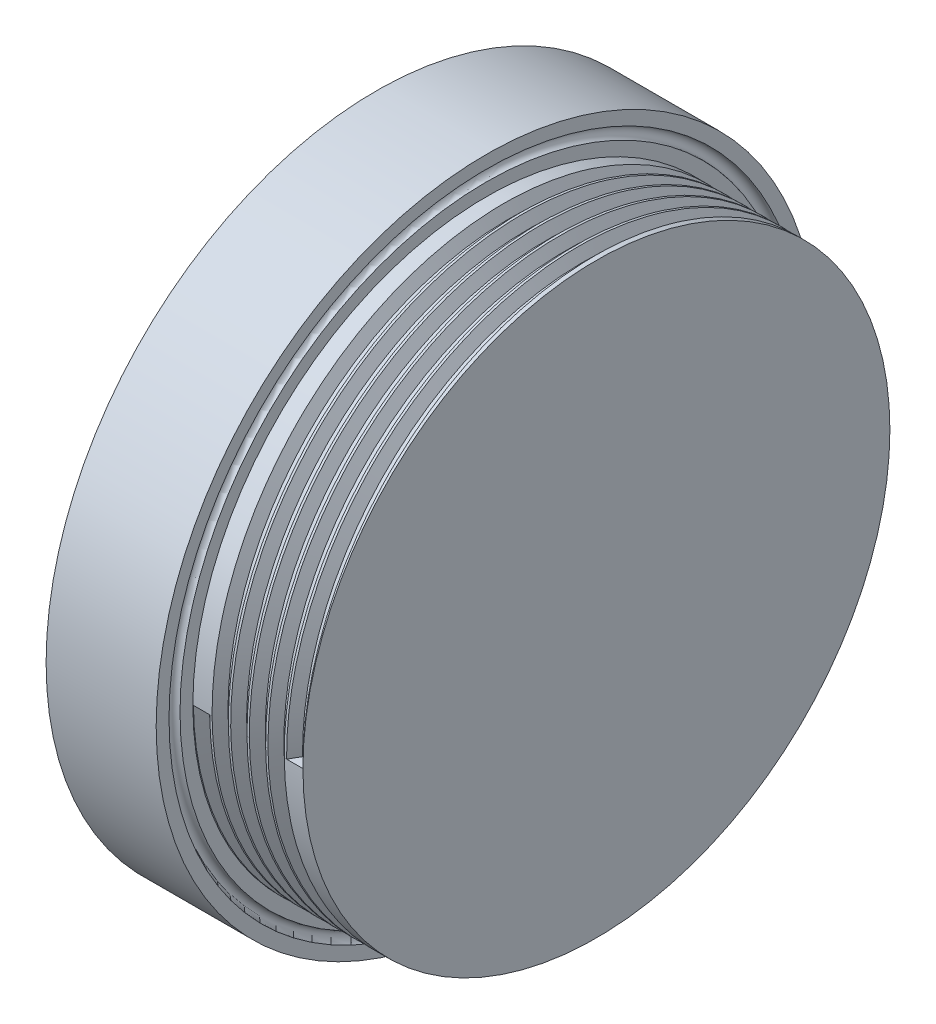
SolidWorks part; units mm, degrees
ref_plane "Front Plane" through (0, 0, 0) normal (0, 0, 1) x (1, 0, 0)
ref_plane "Top Plane" through (0, 0, 0) normal (0, 1, 0) x (1, 0, 0)
ref_plane "Right Plane" through (0, 0, 0) normal (1, 0, 0) x (0, 0, -1)
sketch "Sketch1" plane through (0, 0, 0) normal (0, 0, 1) x (1, 0, 0)
  line L0 (0, 0) -> (60, 0)
  line L1 (60, 0) -> (60, 80)
  line L2 (60, 80) -> (30, 80)
  line L4 (30, 90) -> (0, 90)
  line L5 (0, 90) -> (0, 0)
  line L6 (30, 90) -> (30, 86.5)
  line L7 (30, 80) -> (30, 83.5)
  arc A0 (30, 86.5) -> (30, 83.5) centre (30, 85) ccw
  dimension "D4" = 1.5
  dimension "D1" = 90
  dimension "D2" = 30
  dimension "D3" = 10
revolve "Body" add sketch "Sketch1" angle 360 about L0
thread "Thread" pitch 5.08 start angle 0, offset 0, length 0, pitch 5.08, diameter 160
ref_plane "Plane1" through (60, 0, 80) normal (0, -1, 0) x (0, 0, 1)
sketch "Thread Profile1" plane through (60, 0, 80) normal (0, -1, 0) x (0, 0, 1)
  line L0 (0, 0) -> (0, 5.08) construction
  line L11 (0, 0) -> (0, 4.445)
  line L12 (0, 4.445) -> (-2.7496, 2.8575)
  line L13 (-2.7496, 2.8575) -> (-2.7496, 1.5875)
  line L15 (-2.7496, 1.5875) -> (0, 0)
  line L17 (-2.7496, 2.2225) -> (0, 2.2225) construction
  point P2 (0, 0)
  dimension "Pitch" = 5.08
  dimension "Profile_Angle" = 60
  dimension "Profile_Land" = 1.27
  dimension "Profile_Height" = 2.7496
sketch "Reference" plane through (0, 0, 0) normal (0, 0, 1) x (1, 0, 0)
  line L0 (0, 0) -> (88.9633, 0) construction
sketch "Reference 2" plane through (30, 0, 0) normal (1, 0, 0) x (0, 0, -1)
  line L0 (-90, 0) -> (90, 0) construction
  circle A0 centre (0, 0) radius 90 construction
